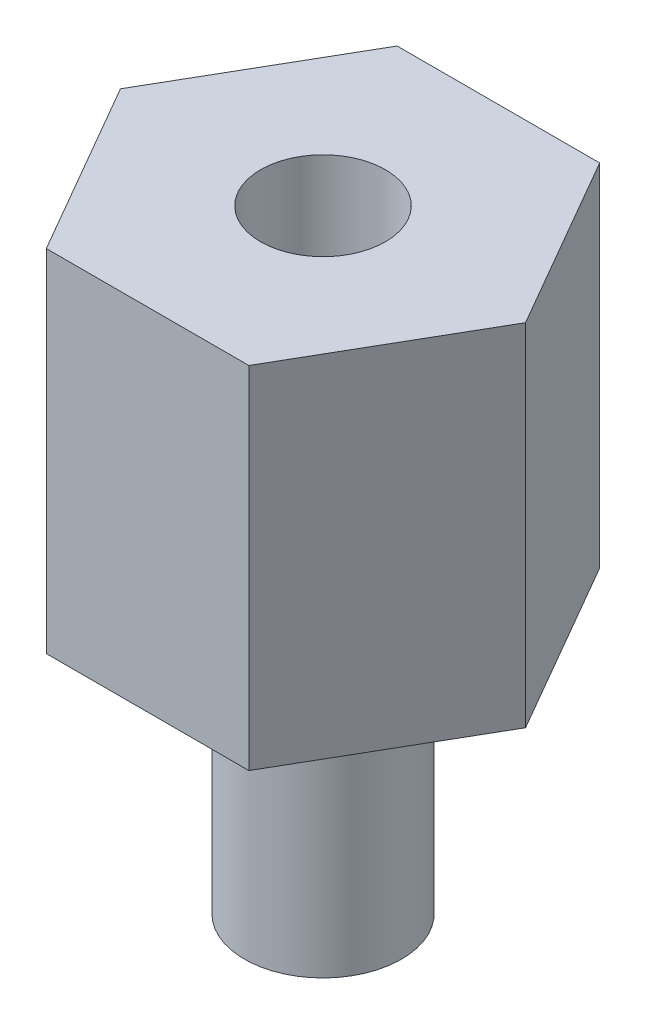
SolidWorks part; units mm, degrees
ref_plane "Front" through (0, 0, 0) normal (0, 0, 1) x (1, 0, 0)
ref_plane "Top" through (0, 0, 0) normal (0, 1, 0) x (1, 0, 0)
ref_plane "Right" through (0, 0, 0) normal (1, 0, 0) x (0, 0, -1)
sketch "Sketch1" plane through (0, 0, 0) normal (0, 1, 0) x (1, 0, 0)
  line L1 (3.6662, 0) -> (1.8331, 3.175)
  line L2 (1.8331, 3.175) -> (-1.8331, 3.175)
  line L3 (-1.8331, 3.175) -> (-3.6662, 0)
  line L4 (-3.6662, 0) -> (-1.8331, -3.175)
  line L5 (-1.8331, -3.175) -> (1.8331, -3.175)
  line L6 (1.8331, -3.175) -> (3.6662, 0)
  circle A1 centre (0, 0) radius 3.175 construction
  dimension "D1" = 6.35
extrude "Base-Extrude" add sketch "Sketch1" along normal blind 6.35
sketch "Sketch2" plane through (0, 0, 0) normal (0, -1, 0) x (1, 0, 0)
  circle A0 centre (0, 0) radius 1.4224
  dimension "D1" = 2.8448
extrude "Extrude1" add sketch "Sketch2" along normal blind 4.7498
hole_wizard "#4-40 Tapped Hole1" positions "Sketch4" profile "Sketch3" tap size "#4-40" standard "Ansi Inch"
sketch "Sketch4" plane through (0, 6.35, 0) normal (0, 1, 0) x (-1, 0, 0)
  point P0 (0, 0)
sketch "Sketch3" plane through (0, 6.35, 0) normal (1, 0, 0) x (0, 0, 1)
  line L0 (0, 0) -> (0, 9.5438)
  line L1 (0, 9.5438) -> (1.1303, 8.8646)
  line L2 (1.1303, 8.8646) -> (1.1303, 0)
  line L5 (1.1303, 0) -> (0, 0)
  line L10 (0, 9.5438) -> (-1.1303, 8.8646) construction
  line L11 (0, -6.35) -> (0, 107.95) construction
  dimension "Tap Drill Dia." = 2.2606
  dimension "Tap Drill Depth" = 8.8646
  dimension "Drill Angle" = 118
